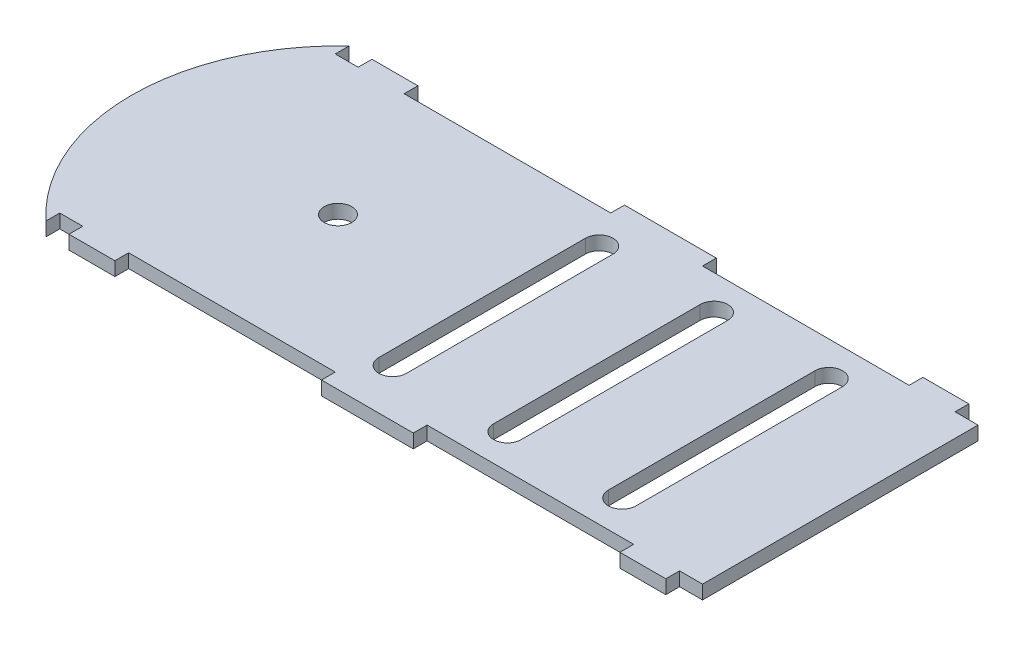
SolidWorks part; units mm, degrees
ref_plane "Front Plane" through (0, 0, 0) normal (0, 0, 1) x (1, 0, 0)
ref_plane "Top Plane" through (0, 0, 0) normal (0, 1, 0) x (1, 0, 0)
ref_plane "Right Plane" through (0, 0, 0) normal (1, 0, 0) x (0, 0, -1)
sketch "Sketch1" plane through (0, 0, 0) normal (0, 1, 0) x (1, 0, 0)
  line L0 (-39.4059, 0) -> (0, 0) construction
  line L1 (-70, 30) -> (70, 30)
  line L2 (-70, 33) -> (-70, 30)
  line L3 (-70, -30) -> (70, -30)
  line L4 (70, 30) -> (70, -30)
  line L5 (-70, 30) -> (70, -30) construction
  line L6 (-70, -30) -> (70, 30) construction
  line L7 (-70, -30) -> (-70, -33)
  arc A0 (-70, 33) -> (-70, -33) centre (-39.4059, 0) ccw
  point P0 (0, 0)
  dimension "D4" = 90
  dimension "D1" = 60
  dimension "D2" = 140
  dimension "D3" = 66
extrude "Boss-Extrude1" add sketch "Sketch1" along normal blind 3
sketch "Sketch2" plane through (0, 0, 0) normal (0, 1, 0) x (1, 0, 0)
  line L0 (-60, 30) -> (-60, 31.5) construction
  line L1 (70, 30) -> (-70, 30) construction
  line L2 (0, 0) -> (5.5006, 0) construction
  line L3 (0, 0) -> (0, 8.2776) construction
  line L5 (-65, 33) -> (-55, 33)
  line L6 (-65, 33) -> (-65, 30)
  line L7 (-65, 30) -> (-55, 30)
  line L8 (-55, 33) -> (-55, 30)
  line L9 (-65, 33) -> (-55, 30) construction
  line L10 (-65, 30) -> (-55, 33) construction
  line L11 (65, 30) -> (55, 33) construction
  line L12 (65, 33) -> (55, 30) construction
  line L13 (60, 30) -> (60, 31.5) construction
  line L14 (55, 33) -> (55, 30)
  line L15 (65, 30) -> (55, 30)
  line L16 (65, 33) -> (65, 30)
  line L17 (65, 33) -> (55, 33)
  line L18 (60, -30) -> (60, -31.5) construction
  line L19 (65, -33) -> (55, -30) construction
  line L20 (65, -30) -> (55, -33) construction
  line L21 (-65, -30) -> (-55, -33) construction
  line L22 (-65, -33) -> (-55, -30) construction
  line L23 (-60, -30) -> (-60, -31.5) construction
  line L24 (65, -33) -> (55, -33)
  line L25 (65, -33) -> (65, -30)
  line L26 (65, -30) -> (55, -30)
  line L27 (55, -33) -> (55, -30)
  line L28 (-55, -33) -> (-55, -30)
  line L29 (-65, -30) -> (-55, -30)
  line L30 (-65, -33) -> (-65, -30)
  line L31 (-65, -33) -> (-55, -33)
  line L32 (0, 30) -> (0, 31.5) construction
  line L33 (-10, -30) -> (10, -33) construction
  line L34 (-10, 33) -> (10, 33)
  line L35 (-10, 33) -> (-10, 30)
  line L36 (-10, 30) -> (10, 30)
  line L37 (10, 33) -> (10, 30)
  line L38 (-10, 33) -> (10, 30) construction
  line L39 (-10, 30) -> (10, 33) construction
  line L40 (-10, -33) -> (10, -30) construction
  line L41 (0, -30) -> (0, -31.5) construction
  line L42 (10, -33) -> (10, -30)
  line L43 (-10, -30) -> (10, -30)
  line L44 (-10, -33) -> (-10, -30)
  line L45 (-10, -33) -> (10, -33)
  line L46 (-70, 30) -> (-70, 33) construction
  dimension "D1" = 3
  dimension "D2" = 10
  dimension "D3" = 5
  dimension "D4" = 20
  dimension "D5" = 3
extrude "Boss-Extrude2" add sketch "Sketch2" along normal blind 3
sketch "Sketch3" plane through (0, 0, 0) normal (0, 1, 0) x (1, 0, 0)
  line L0 (-84.4059, 0) -> (70, 0) construction
  line L1 (20, -22.5) -> (20, 22.5) construction
  line L2 (17, -22.5) -> (17, 22.5)
  line L3 (23, -22.5) -> (23, 22.5)
  line L4 (70, -30) -> (70, 30) construction
  line L5 (45, -22.5) -> (45, 22.5) construction
  line L6 (42, -22.5) -> (42, 22.5)
  line L7 (-5, -22.5) -> (-5, 22.5) construction
  line L8 (48, -22.5) -> (48, 22.5)
  line L15 (-8, -22.5) -> (-8, 22.5)
  line L16 (-2, -22.5) -> (-2, 22.5)
  line L26 (-30, -22.5) -> (-30, 22.5) construction
  line L27 (-33, -22.5) -> (-33, 22.5)
  line L28 (-27, -22.5) -> (-27, 22.5)
  line L29 (-30, -22.5) -> (-30, 22.5) construction
  line L30 (-33, -22.5) -> (-33, 22.5)
  line L31 (-27, -22.5) -> (-27, 22.5)
  arc A0 (42, -22.5) -> (48, -22.5) centre (45, -22.5) ccw
  arc A1 (48, 22.5) -> (42, 22.5) centre (45, 22.5) ccw
  arc A6 (17, -22.5) -> (23, -22.5) centre (20, -22.5) ccw
  arc A7 (23, 22.5) -> (17, 22.5) centre (20, 22.5) ccw
  arc A8 (-70, 33) -> (-70, -33) centre (-39.4059, 0) ccw construction
  arc A9 (-8, -22.5) -> (-2, -22.5) centre (-5, -22.5) ccw
  arc A10 (-2, 22.5) -> (-8, 22.5) centre (-5, 22.5) ccw
  arc A17 (-33, -22.5) -> (-27, -22.5) centre (-30, -22.5) ccw
  arc A18 (-27, 22.5) -> (-33, 22.5) centre (-30, 22.5) ccw
  point P9 (45, 0)
  point P30 (20, 0)
  point P37 (-45, 0)
  point P38 (-5, 0)
  point P44 (-45, 0)
  point P59 (-30, 0)
  point P66 (-30, 0)
  point P73 (-30, 0)
  dimension "D1" = 6
  dimension "D2" = 45
  dimension "D3" = 25
  dimension "D4" = 3
  dimension "D5" = 25
extrude "Cut-Extrude1" cut sketch "Sketch3" along normal blind 10
sketch "Sketch5" plane through (0, 0, 0) normal (0, 1, 0) x (1, 0, 0)
  circle A0 centre (-39.4059, 0) radius 3
  dimension "D1" = 6
extrude "Cut-Extrude2" cut sketch "Sketch5" along normal blind 10
